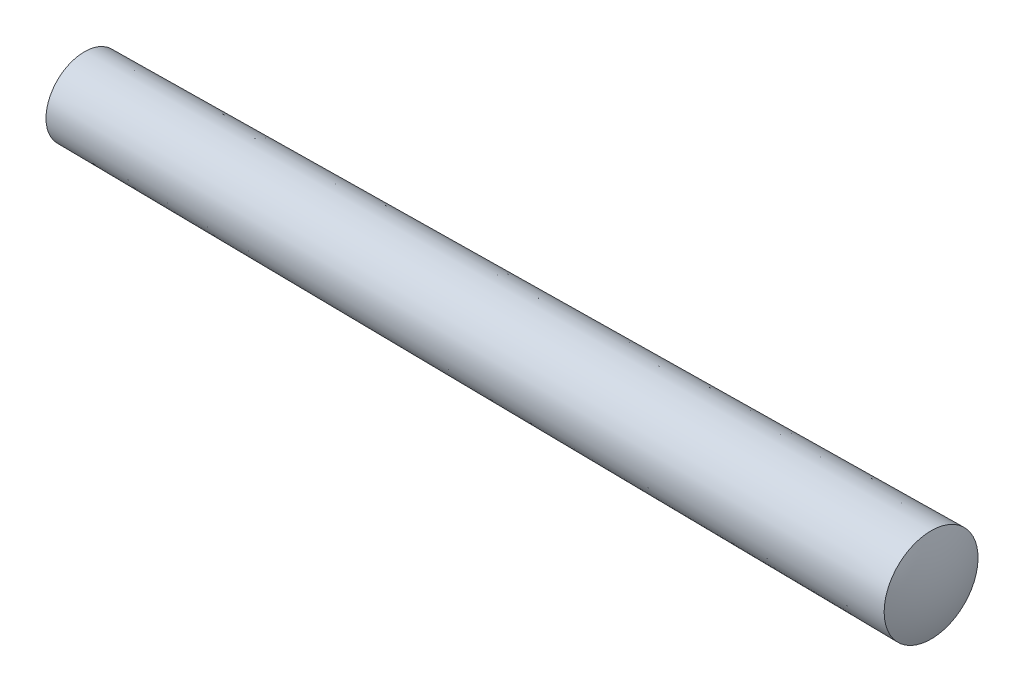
SolidWorks part; units mm, degrees
ref_plane "Plane1" through (0, 0, 0) normal (0, 0, 1) x (1, 0, 0)
ref_plane "Plane2" through (0, 0, 0) normal (0, 1, 0) x (1, 0, 0)
ref_plane "Plane3" through (0, 0, 0) normal (1, 0, 0) x (0, 0, -1)
revolve "Base-Revolve" add sketch "Sketch1" angle 360 about L0
sketch "Sketch1" plane through (0, 0, 0) normal (0, 0, 1) x (1, 0, 0)
  line L0 (0, 0) -> (210, 0) construction
  line L2 (0.5, 2) -> (44.5, 2.44)
  line L4 (0, 0) -> (45, 0)
  line L5 (0.5, -2) -> (44.5, -2.44) construction
  arc A0 (0.5, 2) -> (0, 0) centre (4.25, 0) ccw
  arc A1 (44.5, 2.44) -> (45, 0) centre (38.7964, 0) cw
  dimension "D1" = 0.5
  dimension "Diameter" = 4
  dimension "D2" = 0.573
  dimension "Length" = 45
  dimension "Crown_ht" = 0.5
equation "\"D1@Sketch1\" = \"Crown_ht@Sketch1\""
